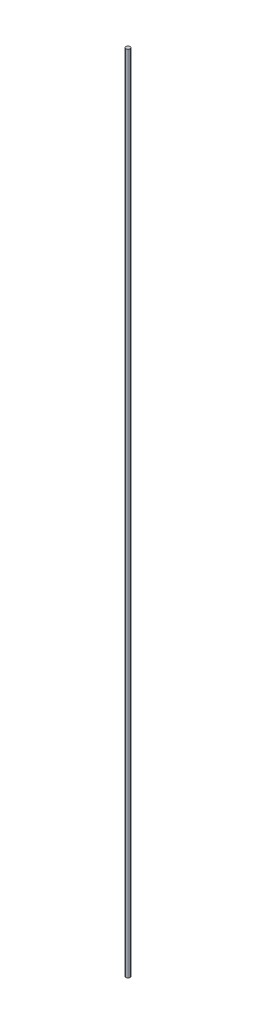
SolidWorks part; units mm, degrees
ref_plane "Front Plane" through (0, 0, 0) normal (0, 0, 1) x (1, 0, 0)
ref_plane "Top Plane" through (0, 0, 0) normal (0, 1, 0) x (1, 0, 0)
ref_plane "Right Plane" through (0, 0, 0) normal (1, 0, 0) x (0, 0, -1)
sketch "Sketch1" plane through (0, 0, 0) normal (0, 1, 0) x (1, 0, 0)
  circle A0 centre (0, 0) radius 19.05
  dimension "D1" = 38.1
extrude "Boss-Extrude1" add sketch "Sketch1" along normal blind 7620
